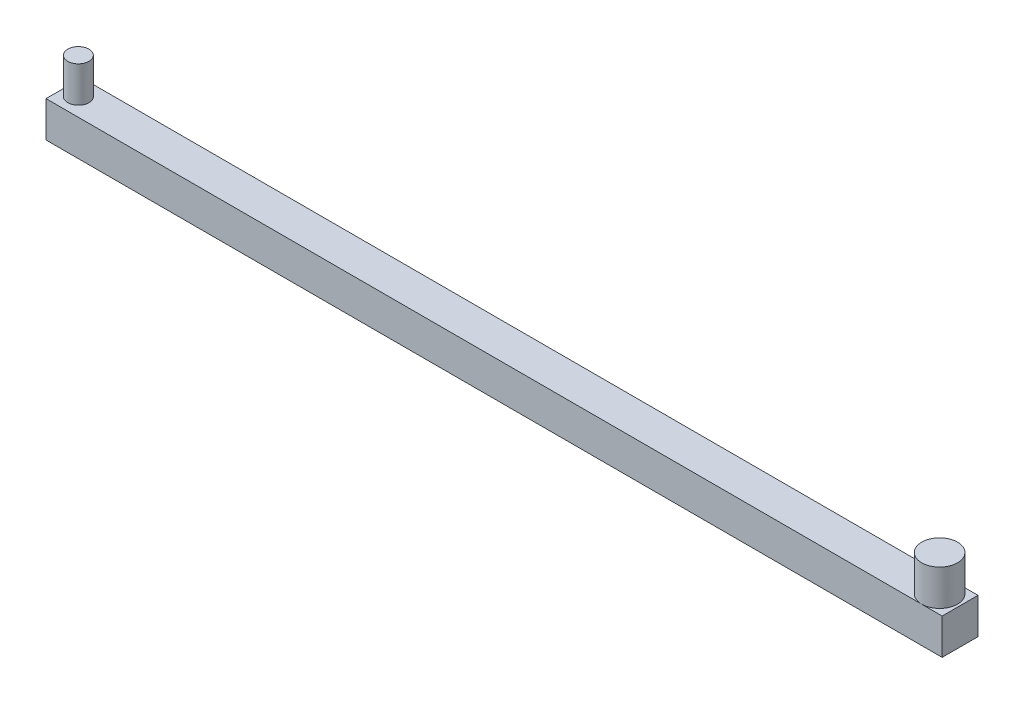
SolidWorks part; units mm, degrees
ref_plane "Front Plane" through (0, 0, 0) normal (0, 0, 1) x (1, 0, 0)
ref_plane "Top Plane" through (0, 0, 0) normal (0, 1, 0) x (1, 0, 0)
ref_plane "Right Plane" through (0, 0, 0) normal (1, 0, 0) x (0, 0, -1)
sketch "Sketch1" plane through (0, 0, 0) normal (0, 1, 0) x (1, 0, 0)
  line L1 (-23.0769, 2.6113) -> (26.9231, 2.6113)
  line L2 (-23.0769, 2.6113) -> (-23.0769, 0.6113)
  line L3 (-23.0769, 0.6113) -> (26.9231, 0.6113)
  line L4 (26.9231, 2.6113) -> (26.9231, 0.6113)
  dimension "D1" = 50
  dimension "D2" = 2
extrude "Boss-Extrude1" add sketch "Sketch1" along normal blind 2
sketch "Sketch3" plane through (0, 2, 0) normal (0, 1, 0) x (1, 0, 0)
  circle A0 centre (-22.2694, 1.6113) radius 0.59
  circle A1 centre (25.7806, 1.6113) radius 1
  point P4 (-22.2694, 1.6113)
  dimension "D1" = 1.18
  dimension "D2" = 48.05
extrude "Boss-Extrude2" add sketch "Sketch3" along normal blind 2
